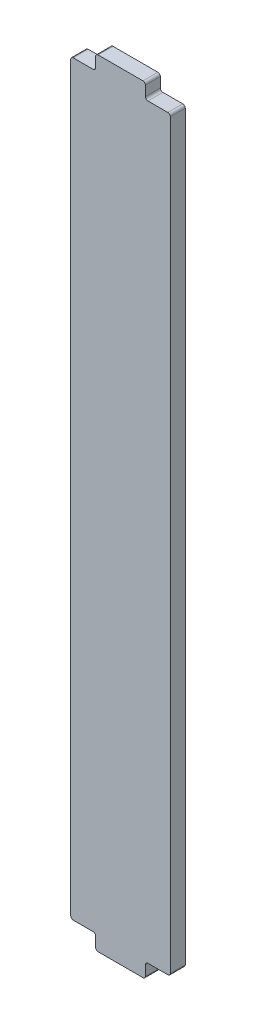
SolidWorks part; units mm, degrees
ref_plane "Front Plane" through (0, 0, 0) normal (0, 0, 1) x (1, 0, 0)
ref_plane "Top Plane" through (0, 0, 0) normal (0, 1, 0) x (1, 0, 0)
ref_plane "Right Plane" through (0, 0, 0) normal (1, 0, 0) x (0, 0, -1)
sketch "Sketch1" plane through (0, 0, 0) normal (0, 0, 1) x (1, 0, 0)
  line L0 (-9, 0) -> (9, 0)
  line L1 (10, 1) -> (10, 5)
  line L2 (11, 6) -> (19, 6)
  line L3 (20, 7) -> (20, 305)
  line L4 (19, 306) -> (11, 306)
  line L5 (10, 307) -> (10, 311)
  line L6 (9, 312) -> (-9, 312)
  line L7 (0, 0) -> (0, 312) construction
  line L8 (-10, 307) -> (-10, 311)
  line L9 (-19, 306) -> (-11, 306)
  line L10 (-20, 7) -> (-20, 305)
  line L11 (-11, 6) -> (-19, 6)
  line L12 (-10, 1) -> (-10, 5)
  arc A0 (9, 0) -> (10, 1) centre (9, 1) ccw
  arc A1 (-9, 0) -> (-10, 1) centre (-9, 1) cw
  arc A2 (10, 311) -> (9, 312) centre (9, 311) ccw
  arc A3 (-9, 312) -> (-10, 311) centre (-9, 311) ccw
  arc A4 (-10, 307) -> (-11, 306) centre (-11, 307) cw
  arc A5 (11, 306) -> (10, 307) centre (11, 307) cw
  arc A6 (10, 5) -> (11, 6) centre (11, 5) cw
  arc A7 (-11, 6) -> (-10, 5) centre (-11, 5) cw
  arc A8 (-20, 7) -> (-19, 6) centre (-19, 7) ccw
  arc A9 (19, 6) -> (20, 7) centre (19, 7) ccw
  arc A10 (20, 305) -> (19, 306) centre (19, 305) ccw
  arc A11 (-19, 306) -> (-20, 305) centre (-19, 305) ccw
  point P3 (0, 0)
  point P18 (10, 0)
  point P21 (-10, 0)
  point P24 (10, 312)
  point P27 (-10, 312)
  point P30 (-10, 306)
  point P33 (10, 306)
  point P36 (10, 6)
  point P39 (-10, 6)
  point P42 (-20, 6)
  point P45 (20, 6)
  point P48 (20, 306)
  point P51 (-20, 306)
  dimension "D5" = 1
  dimension "D1" = 20
  dimension "D2" = 6
  dimension "D3" = 300
  dimension "D4" = 10
extrude "Boss-Extrude1" add sketch "Sketch1" along normal blind 6
